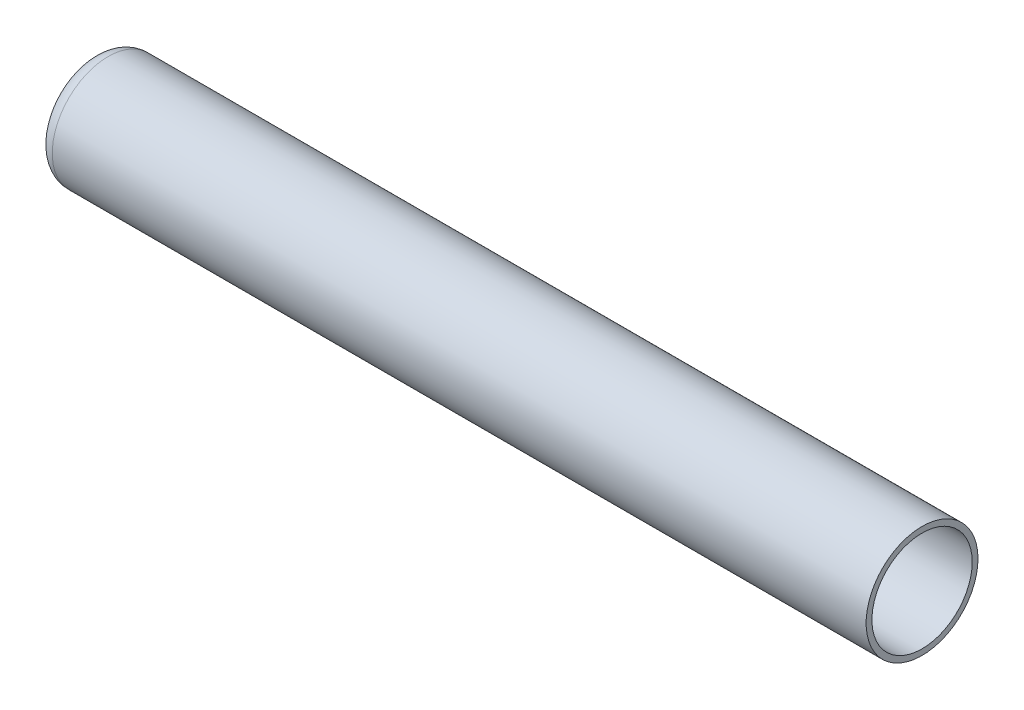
SolidWorks part; units mm, degrees
ref_plane "Plan de face" through (0, 0, 0) normal (0, 0, 1) x (1, 0, 0)
ref_plane "Plan de dessus" through (0, 0, 0) normal (0, 1, 0) x (1, 0, 0)
ref_plane "Plan de droite" through (0, 0, 0) normal (1, 0, 0) x (0, 0, -1)
sketch "Esquisse1" plane through (0, 0, 0) normal (0, 0, 1) x (1, 0, 0)
  line L0 (0, 10.5) -> (0, 0)
  line L1 (0, 0) -> (1.5, 0)
  line L2 (1.5, 0) -> (1.5, 10.5)
  line L3 (4, 13) -> (215, 13)
  line L4 (215, 13) -> (215, 14.5)
  line L5 (215, 14.5) -> (4, 14.5)
  line L6 (-0.0013, 0) -> (241, 0) construction
  arc A0 (1.5, 10.5) -> (4, 13) centre (4, 10.5) cw
  arc A1 (4, 14.5) -> (0, 10.5) centre (4, 10.5) ccw
  dimension "D2" = 4
  dimension "D1" = 215
  dimension "D3" = 1.5
  dimension "D4" = 26
revolve "Révolution1" add sketch "Esquisse1" angle 360 about L6
